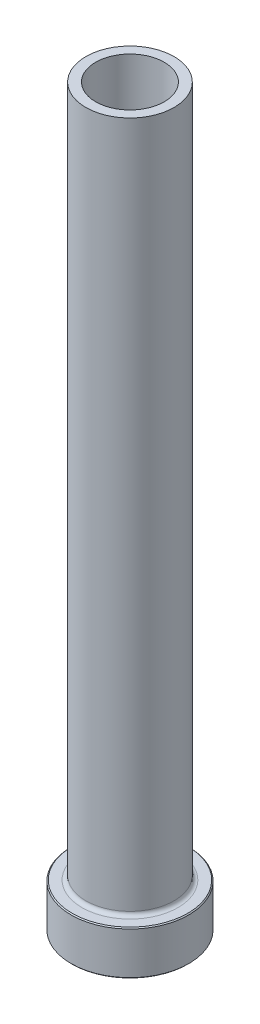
SolidWorks part; units mm, degrees
ref_plane "Front Plane" through (0, 0, 0) normal (0, 0, 1) x (1, 0, 0)
ref_plane "Top Plane" through (0, 0, 0) normal (0, 1, 0) x (1, 0, 0)
ref_plane "Right Plane" through (0, 0, 0) normal (1, 0, 0) x (0, 0, -1)
sketch "Sketch1" plane through (0, 0, 0) normal (0, 0, 1) x (1, 0, 0)
  line L0 (-7, 150) -> (-9, 150)
  line L1 (-9, 150) -> (-9, 9)
  line L2 (-9, 9) -> (-12, 9)
  line L3 (-12, 9) -> (-12, 0)
  line L4 (13.2, 0) -> (-13.2, 0) construction
  line L5 (-12, 0) -> (-7.25, 0)
  line L6 (-7, 95) -> (-7, 150)
  line L7 (0, 92.1877) -> (0, -15.5353) construction
  line L8 (0, -13.2) -> (0, 13.2) construction
  line L9 (-7, 95) -> (-7.25, 83)
  line L10 (-7.25, 83) -> (-7.25, 0)
  dimension "D1" = 0.25
  dimension "ID" = 14
  dimension "OD" = 18
  dimension "L" = 150
  dimension "H" = 24
  dimension "T" = 9
  dimension "N" = 55
  dimension "D2" = 12
revolve "Revolve1" add sketch "Sketch1" angle 360 about L7
fillet "Fillet1" radius 0.8 1 edges at (0, 9, 9)
chamfer "Chamfer1" distance 0.2 angle 45 2 edges at (0, 9, 12) (0, 0, 12)
chamfer "Chamfer3" distance 0.5 angle 45 1 edges at (0, 0, 7.25)
